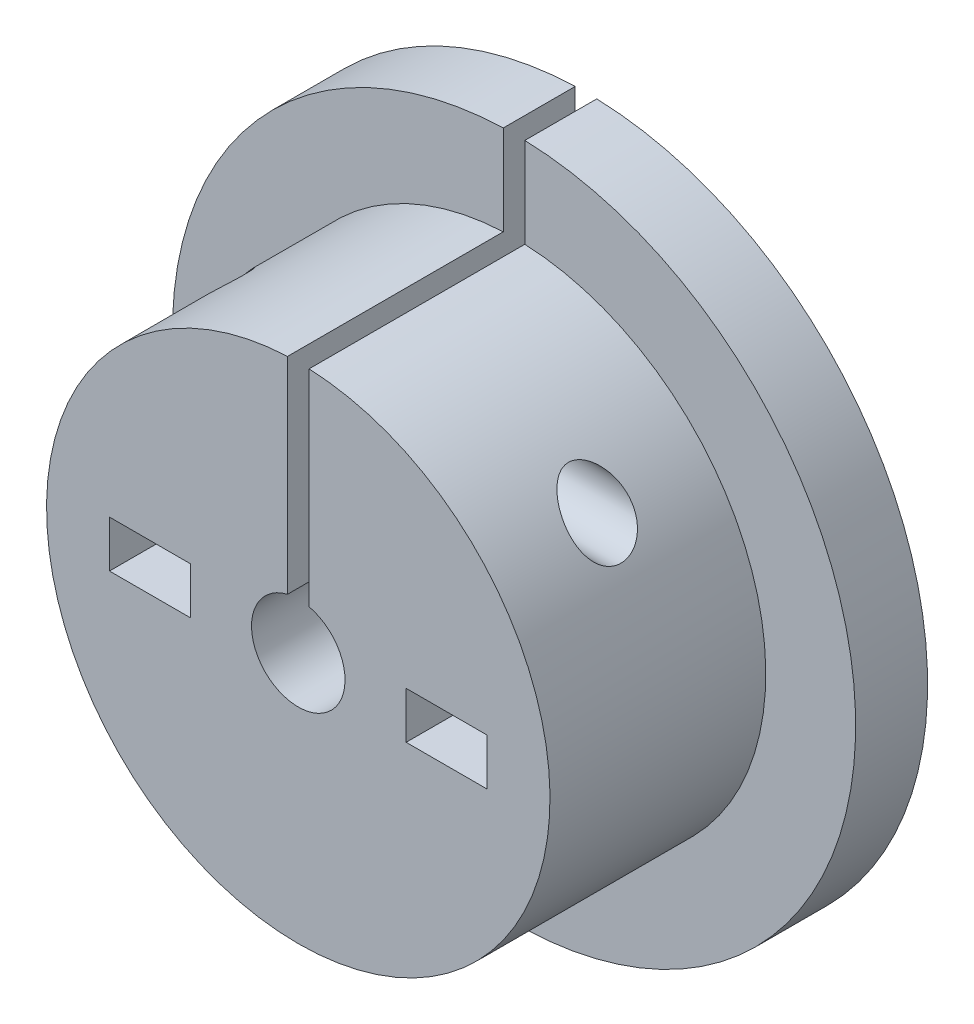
SolidWorks part; units mm, degrees
ref_plane "前视基准面" through (0, 0, 0) normal (0, 0, 1) x (1, 0, 0)
ref_plane "上视基准面" through (0, 0, 0) normal (0, 1, 0) x (1, 0, 0)
ref_plane "右视基准面" through (0, 0, 0) normal (1, 0, 0) x (0, 0, -1)
other "Configuration Table"
sketch "草图1" plane through (0, 0, 0) normal (0, 0, 1) x (1, 0, 0)
  circle A0 centre (0, 0) radius 19
extrude "Horn_flange_D38" add sketch "草图1" along normal blind 4
sketch "草图2" plane through (0, 0, 0) normal (0, 0, 1) x (1, 0, 0)
  circle A0 centre (0, 0) radius 14
extrude "Shaft_clamp_hub" add sketch "草图2" along normal blind 16
sketch "草图3" plane through (0, 0, 0) normal (0, 0, 1) x (1, 0, 0)
  circle A0 centre (0, 0) radius 2.6
extrude "Shaft_D5p2" cut sketch "草图3" against normal through all and the other way through all
sketch "草图4" plane through (0, 0, 0) normal (0, 0, 1) x (1, 0, 0)
  line L1 (-0.6, 2.2) -> (0.6, 2.2)
  line L2 (-0.6, 2.2) -> (-0.6, 20)
  line L3 (-0.6, 20) -> (0.6, 20)
  line L4 (0.6, 2.2) -> (0.6, 20)
extrude "Clamp_split" cut sketch "草图4" against normal through all and the other way through all
sketch "草图5" plane through (0, 0, 0) normal (0, 0, 1) x (1, 0, 0)
  line L1 (-10.5, -1.3) -> (-6, -1.3)
  line L2 (-10.5, -1.3) -> (-10.5, 1.3)
  line L3 (-10.5, 1.3) -> (-6, 1.3)
  line L4 (-6, -1.3) -> (-6, 1.3)
  line L6 (6, -1.3) -> (10.5, -1.3)
  line L7 (6, -1.3) -> (6, 1.3)
  line L8 (6, 1.3) -> (10.5, 1.3)
  line L9 (10.5, -1.3) -> (10.5, 1.3)
extrude "Horn_two_adjustment_slots_VERIFY_HORN" cut sketch "草图5" against normal through all and the other way through all
sketch "草图6" plane through (0, 0, 0) normal (1, 0, 0) x (0, 0, -1)
  circle A0 centre (-10, 9) radius 1.7
extrude "Coupler_clamp_M3" cut sketch "草图6" against normal through all and the other way through all
